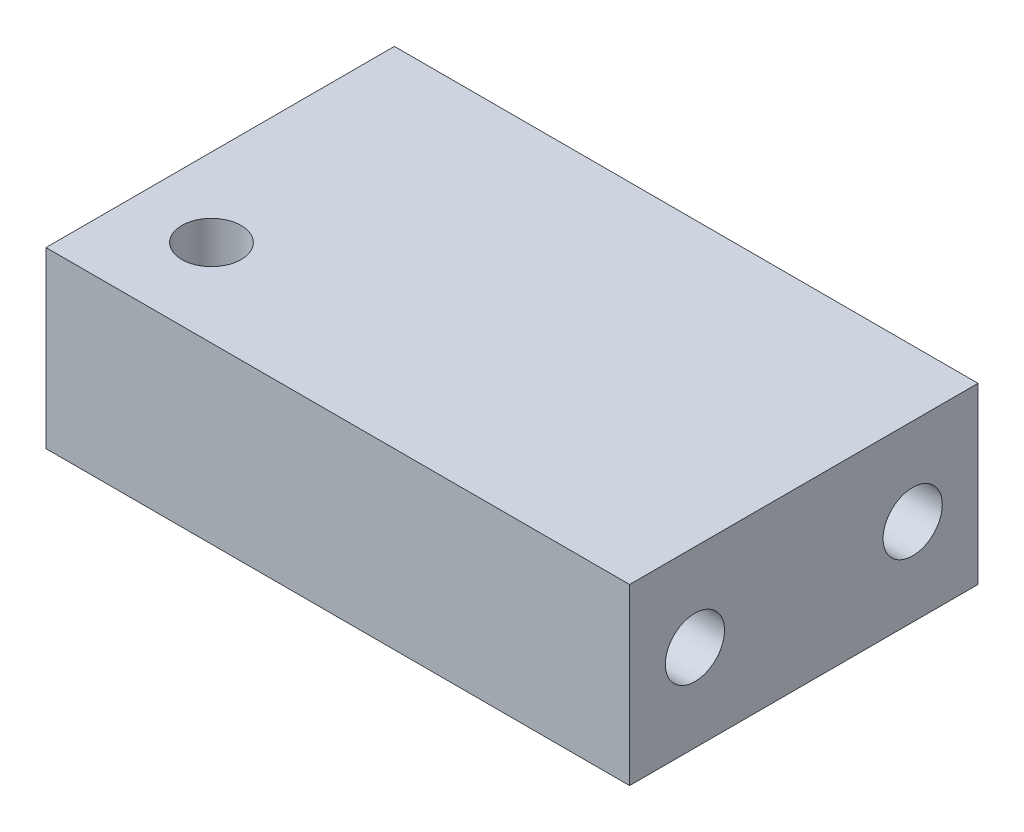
SolidWorks part; units mm, degrees
ref_plane "Face" through (0, 0, 0) normal (0, 0, 1) x (1, 0, 0)
ref_plane "Dessus" through (0, 0, 0) normal (0, 1, 0) x (1, 0, 0)
ref_plane "Droite" through (0, 0, 0) normal (1, 0, 0) x (0, 0, -1)
sketch "Esquisse1" plane through (0, 0, 0) normal (0, 0, 1) x (1, 0, 0)
  line L1 (10.7479, -7.8098) -> (77.7479, -7.8098)
  line L2 (10.7479, -7.8098) -> (10.7479, -27.8098)
  line L3 (10.7479, -27.8098) -> (77.7479, -27.8098)
  line L4 (77.7479, -7.8098) -> (77.7479, -27.8098)
  dimension "D1" = 20
  dimension "D2" = 67
extrude "Base-Extrusion" add sketch "Esquisse1" along normal blind 40
hole_wizard "Trou taraudé M8x1.251" positions "Esquisse3" profile "Esquisse2" tap size "M8x1.25" standard "ISO"
sketch "Esquisse3" plane through (0, -7.8098, 0) normal (0, 1, 0) x (-1, 0, 0)
  line L0 (-10.7479, 40) -> (-10.7479, 0) construction
  line L1 (-77.7479, 40) -> (-10.7479, 40) construction
  point P0 (-19.7479, 30)
  dimension "D1" = 9
  dimension "D2" = 10
sketch "Esquisse2" plane through (19.7479, -7.8098, 30) normal (1, 0, 0) x (0, 0, 1)
  line L0 (0, 0) -> (0, 28.2929)
  line L1 (0, 28.2929) -> (3.4, 26.25)
  line L2 (3.4, 26.25) -> (3.4, 0)
  line L5 (3.4, 0) -> (0, 0)
  line L10 (0, 28.2929) -> (-3.4, 26.25) construction
  line L11 (0, -6.35) -> (0, 107.95) construction
  dimension "Diamètre du trou pour taraudage" = 6.8
  dimension "Profondeur du trou pour taraudage" = 26.25
  dimension "Angle de pointe" = 118
hole_wizard "Trou taraudé M8x1.252" positions "Esquisse5" profile "Esquisse4" tap size "M8x1.25" standard "ISO"
sketch "Esquisse5" plane through (77.7479, 0, 0) normal (1, 0, 0) x (0, 0, -1)
  line L0 (0, -27.8098) -> (0, -7.8098) construction
  line L1 (-40, -7.8098) -> (0, -7.8098) construction
  point P0 (-7.5, -17.8098)
  point P1 (-32.5, -17.8098)
  dimension "D1" = 25
  dimension "D2" = 7.5
  dimension "D3" = 10
  dimension "D4" = 10
sketch "Esquisse4" plane through (77.7479, -17.8098, 7.5) normal (0, 1, 0) x (0, 0, -1)
  line L0 (0, 0) -> (0, 38.2929)
  line L1 (0, 38.2929) -> (3.4, 36.25)
  line L2 (3.4, 36.25) -> (3.4, 0)
  line L5 (3.4, 0) -> (0, 0)
  line L10 (0, 38.2929) -> (-3.4, 36.25) construction
  line L11 (0, -6.35) -> (0, 107.95) construction
  dimension "Diamètre du perçage" = 6.8
  dimension "Profondeur du perçage" = 36.25
  dimension "Angle de pointe" = 118
